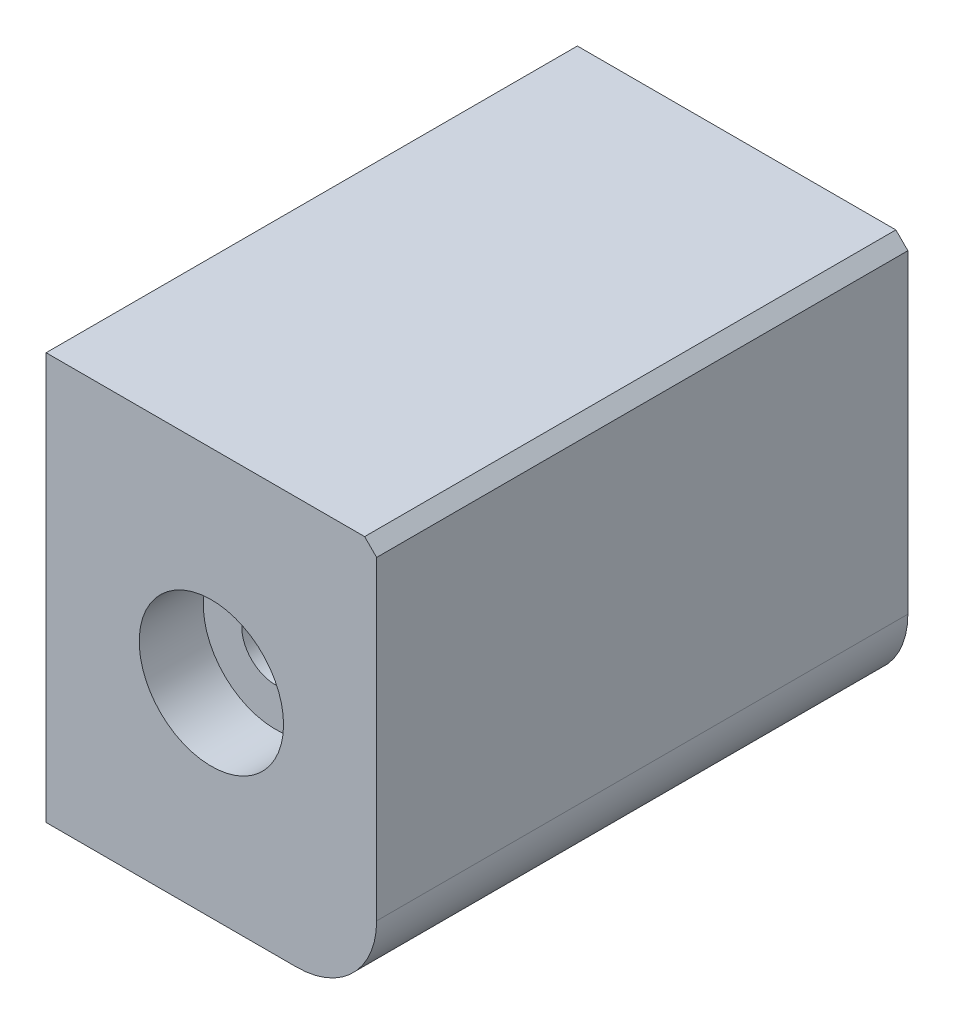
SolidWorks part; units mm, degrees
ref_plane "Front Plane" through (0, 0, 0) normal (0, 0, 1) x (1, 0, 0)
ref_plane "Top Plane" through (0, 0, 0) normal (0, 1, 0) x (1, 0, 0)
ref_plane "Right Plane" through (0, 0, 0) normal (1, 0, 0) x (0, 0, -1)
sketch "Sketch1" plane through (0, 0, 0) normal (0, 0, 1) x (1, 0, 0)
  line L1 (41.27, -40.8) -> (41.27, 0)
  line L3 (0, -50.8) -> (31.27, -50.8)
  line L4 (0, -50.8) -> (0, 0)
  line L5 (0, 0) -> (41.27, 0)
  arc A1 (41.27, -40.8) -> (31.27, -50.8) centre (31.27, -40.8) cw
  dimension "D1" = 10
  dimension "D2" = 41.27
  dimension "D3" = 50.8
  dimension "D4" = 90
  dimension "D5" = 90
  dimension "D6" = 90
extrude "Extrude1" add sketch "Sketch1" along normal blind 66.33
sketch "Sketch2" plane through (0, 0, 66.33) normal (0, 0, 1) x (1, 0, 0)
  circle A0 centre (20.635, -25.4) radius 9.01
  dimension "D1" = 20.635
  dimension "D2" = 18.02
  dimension "D3" = 25.4
extrude "Cut-Extrude1" cut sketch "Sketch2" against normal blind 8
sketch "Sketch3" plane through (0, 0, 58.33) normal (0, 0, 1) x (1, 0, 0)
  circle A0 centre (20.625, -25.4) radius 4.2
  dimension "D1" = 8.4
  dimension "D2" = 20.625
  dimension "D3" = 25.4
extrude "Cut-Extrude2" cut sketch "Sketch3" against normal blind 15.5
sketch "Sketch4" plane through (0, 0, 42.83) normal (0, 0, 1) x (1, 0, 0)
  circle A1 centre (20.625, -25.4) radius 4.2
  circle A2 centre (20.625, -25.4) radius 4.2
  dimension "D1" = 0
extrude "Cut-Extrude4" cut sketch "Sketch4" against normal through all draft 60
sketch "Sketch5" plane through (0, 0, 0) normal (0, 0, -1) x (-1, 0, 0)
  circle A0 centre (-20.635, -25.4) radius 4.2
  dimension "D1" = 8.4
  dimension "D2" = 20.635
  dimension "D3" = 25.4
extrude "Cut-Extrude5" cut sketch "Sketch5" against normal blind 22
sketch "Sketch6" plane through (0, 0, 0) normal (0, 0, -1) x (-1, 0, 0)
  line L0 (-20.635, 2.041) -> (-20.635, -53.435) construction
  line L1 (0, 0) -> (0, -50.8) construction
  circle A1 centre (-20.635, -25.4) radius 9.01
  circle A3 centre (-20.635, -39.4) radius 3
  dimension "D1" = 18.02
  dimension "D4" = 14
  dimension "D5" = 6
  dimension "D2" = 20.635
  dimension "D3" = 25.4
extrude "Cut-Extrude6" cut sketch "Sketch6" against normal blind 8
sketch "Sketch9" plane through (0, 0, 22) normal (0, 0, -1) x (-1, 0, 0)
  circle A1 centre (-20.635, -25.4) radius 4.2
  circle A2 centre (-20.635, -25.4) radius 4.2
  dimension "D1" = 0
extrude "Extrude2" cut sketch "Sketch9" against normal through all draft 60
chamfer "Chamfer2" distance 1.5 angle 45 1 edges at (41.27, 0, 33.165)
